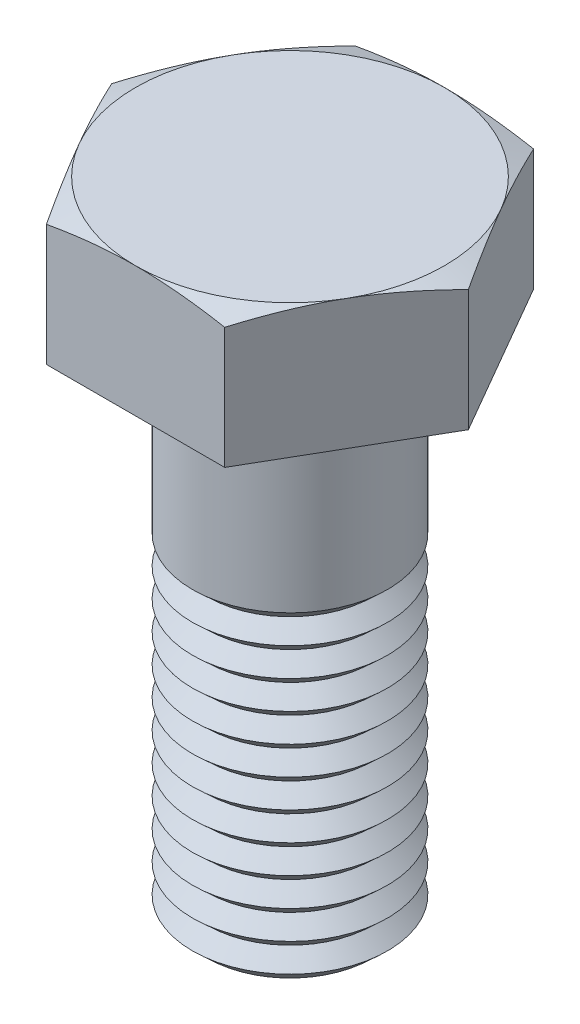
SolidWorks part; units mm, degrees
ref_plane "前基準面" through (0, 0, 0) normal (0, 0, 1) x (1, 0, 0)
ref_plane "上基準面" through (0, 0, 0) normal (0, 1, 0) x (1, 0, 0)
ref_plane "右基準面" through (0, 0, 0) normal (1, 0, 0) x (0, 0, -1)
sketch "草圖2" plane through (0, 0, 0) normal (0, 1, 0) x (1, 0, 0)
  line L0 (10.9697, 0) -> (5.4848, 9.5)
  line L1 (5.4848, 9.5) -> (-5.4848, 9.5)
  line L2 (-5.4848, 9.5) -> (-10.9697, 0)
  line L3 (-10.9697, 0) -> (-5.4848, -9.5)
  line L4 (-5.4848, -9.5) -> (5.4848, -9.5)
  line L5 (5.4848, -9.5) -> (10.9697, 0)
  circle A0 centre (0, 0) radius 9.5 construction
extrude "伸長1" add sketch "草圖2" against normal blind 8
sketch "草圖3" plane through (0, 0, 0) normal (0, 0, 1) x (1, 0, 0)
  line L0 (0, 1.7161) -> (0, -5.4265) construction
  line L1 (-11.5476, 0) -> (-9.5, 0)
  line L2 (-9.5, 0) -> (-11.5476, -0.7453)
  line L3 (-11.5476, -0.7453) -> (-11.5476, 0)
  line L4 (-10.9697, 0) -> (-5.4848, 0) construction
  dimension "D1" = 9.5
  dimension "D2" = 20
revolve "除料-旋轉1" cut sketch "草圖3" angle 360 about L0
sketch "草圖4" plane through (0, 0, 0) normal (0, 0, 1) x (1, 0, 0)
  line L0 (0, 0.8474) -> (0, -196.1971) construction
  line L1 (0, -8) -> (0, -38)
  line L2 (5.053, -35.625) -> (6, -36.5)
  line L3 (0, -8) -> (6, -8)
  line L4 (5.4848, -8) -> (10.9697, -8) construction
  line L5 (6, -8) -> (6, -19)
  line L6 (6, -19) -> (5.053, -19.875)
  line L7 (5.053, -19.875) -> (6, -20.75)
  line L8 (6.0303, -38.222) -> (3.3995, -40.6528)
  line L9 (6, -20.75) -> (5.053, -21.625)
  line L10 (5.053, -21.625) -> (6, -22.5)
  line L11 (6, -22.5) -> (5.053, -23.375)
  line L12 (5.053, -23.375) -> (6, -24.25)
  line L13 (6, -24.25) -> (5.053, -25.125)
  line L14 (5.053, -25.125) -> (6, -26)
  line L15 (6, -26) -> (5.053, -26.875)
  line L16 (5.053, -26.875) -> (6, -27.75)
  line L17 (6, -27.75) -> (5.053, -28.625)
  line L18 (5.053, -28.625) -> (6, -29.5)
  line L19 (6, -29.5) -> (5.053, -30.375)
  line L20 (5.053, -30.375) -> (6, -31.25)
  line L21 (6, -31.25) -> (5.053, -32.125)
  line L22 (5.053, -32.125) -> (6, -33)
  line L23 (6, -33) -> (5.053, -33.875)
  line L24 (5.053, -33.875) -> (6, -34.75)
  line L25 (6, -34.75) -> (5.053, -35.625)
  line L26 (3.7442, -36.1657) -> (4.5561, -36.9159)
  line L27 (6, -36.5) -> (5.053, -37.375)
  line L28 (5.053, -37.375) -> (6, -38.25)
  line L29 (3.7442, -34.4157) -> (4.5561, -35.1659)
  line L30 (1.2285, -37.3413) -> (0.595, -36.7559)
  line L31 (1.3125, -42.6689) -> (0.679, -42.0835)
  line L32 (4.8662, -42.7976) -> (4.2327, -43.383)
  line L33 (1.2565, -39.1172) -> (0.623, -38.5318)
  line L34 (4.8598, -44.5535) -> (4.2262, -45.1389)
  line L35 (1.2845, -40.893) -> (0.651, -40.3077)
  line L36 (4.7379, -46.4161) -> (4.1044, -47.0015)
  line L37 (5.0777, -40.8521) -> (4.4442, -41.4375)
  line L38 (4.8469, -48.0654) -> (5.7873, -47.1965)
  line L39 (6, -38.25) -> (5.053, -39.125)
  line L40 (5.4984, -36.9634) -> (4.6866, -37.7136)
  line L41 (1.2556, -35.6163) -> (0.622, -35.0309)
  line L42 (1.5509, -44.6392) -> (1.1225, -44.2433)
  line L43 (0, -38) -> (5.053, -39.125)
  line L44 (5.053, -39.125) -> (6, -40)
  line L45 (6, -41.75) -> (5.053, -42.625)
  line L46 (6, -40) -> (5.053, -40.875)
  line L49 (5.053, -40.875) -> (6, -41.75)
  dimension "D1" = 30
  dimension "D2" = 6
  dimension "D3" = 11
  dimension "D4" = 5.053
  dimension "D5" = 0.875
  dimension "D6" = 1.75
revolve "旋轉1" add sketch "草圖4" angle 360 about L0
